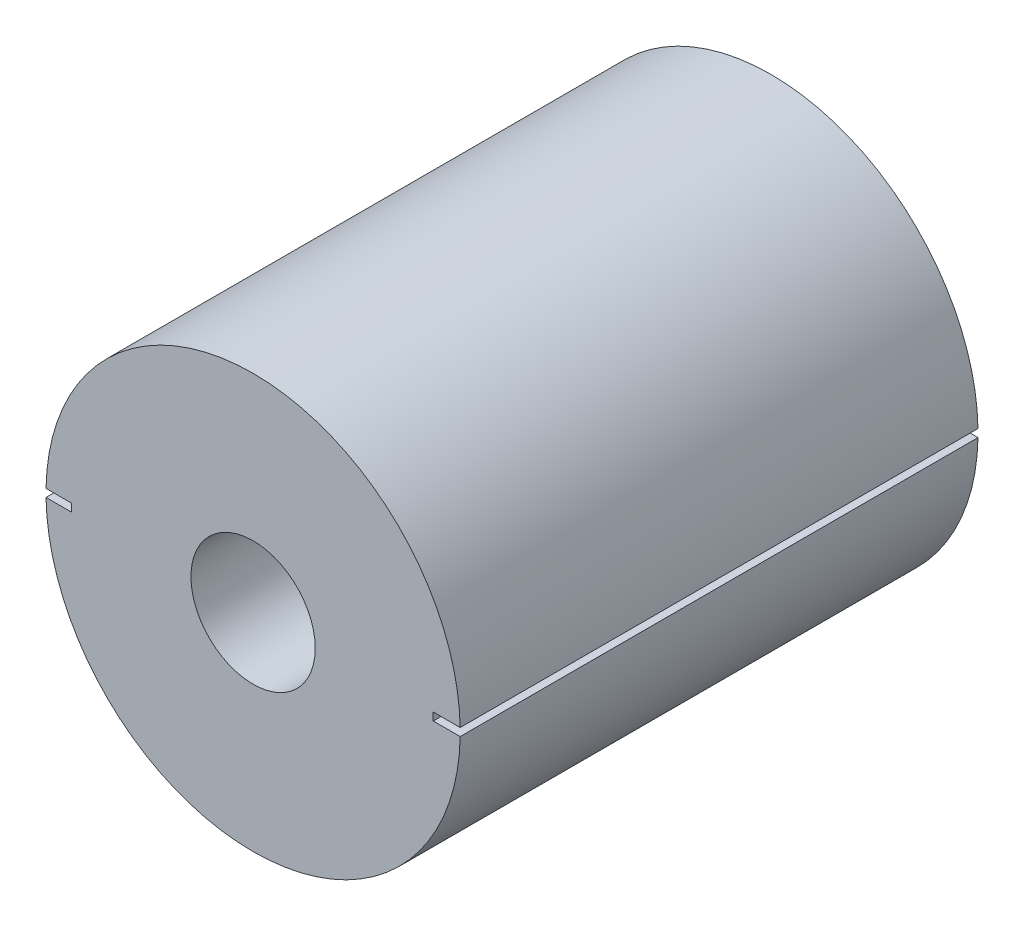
SolidWorks part; units mm, degrees
ref_plane "Front Plane" through (0, 0, 0) normal (0, 0, 1) x (1, 0, 0)
ref_plane "Top Plane" through (0, 0, 0) normal (0, 1, 0) x (1, 0, 0)
ref_plane "Right Plane" through (0, 0, 0) normal (1, 0, 0) x (0, 0, -1)
sketch "Sketch1" plane through (0, 0, 0) normal (0, 0, 1) x (1, 0, 0)
  circle A0 centre (0, 0) radius 10
  dimension "D1" = 20
extrude "Boss-Extrude1" add sketch "Sketch1" along normal blind 25
sketch "Sketch2" plane through (0, 0, 25) normal (0, 0, 1) x (1, 0, 0)
  circle A0 centre (0, 0) radius 3
  dimension "D1" = 6
extrude "Cut-Extrude1" cut sketch "Sketch2" against normal blind 12.5
sketch "Sketch3" plane through (0, 0, 0) normal (0, 0, -1) x (-1, 0, 0)
  circle A0 centre (0, 0) radius 4
  dimension "D1" = 8
extrude "Cut-Extrude2" cut sketch "Sketch3" against normal blind 12.5
sketch "Sketch4" plane through (0, 0, 0) normal (0, 0, -1) x (-1, 0, 0)
  line L1 (8.7693, 0.1887) -> (11.2307, 0.1887)
  line L2 (8.7693, 0.1887) -> (8.7693, -0.1887)
  line L3 (8.7693, -0.1887) -> (11.2307, -0.1887)
  line L4 (11.2307, 0.1887) -> (11.2307, -0.1887)
  line L5 (8.7693, 0.1887) -> (11.2307, -0.1887) construction
  line L6 (8.7693, -0.1887) -> (11.2307, 0.1887) construction
  line L7 (-11.303, 0.1887) -> (-8.697, 0.1887)
  line L8 (-11.303, 0.1887) -> (-11.303, -0.1887)
  line L9 (-11.303, -0.1887) -> (-8.697, -0.1887)
  line L10 (-8.697, 0.1887) -> (-8.697, -0.1887)
  line L11 (-11.303, 0.1887) -> (-8.697, -0.1887) construction
  line L12 (-11.303, -0.1887) -> (-8.697, 0.1887) construction
  circle A0 centre (0, 0) radius 10 construction
  point P0 (10, 0)
  point P7 (-10, 0)
extrude "Cut-Extrude3" cut sketch "Sketch4" against normal through all
